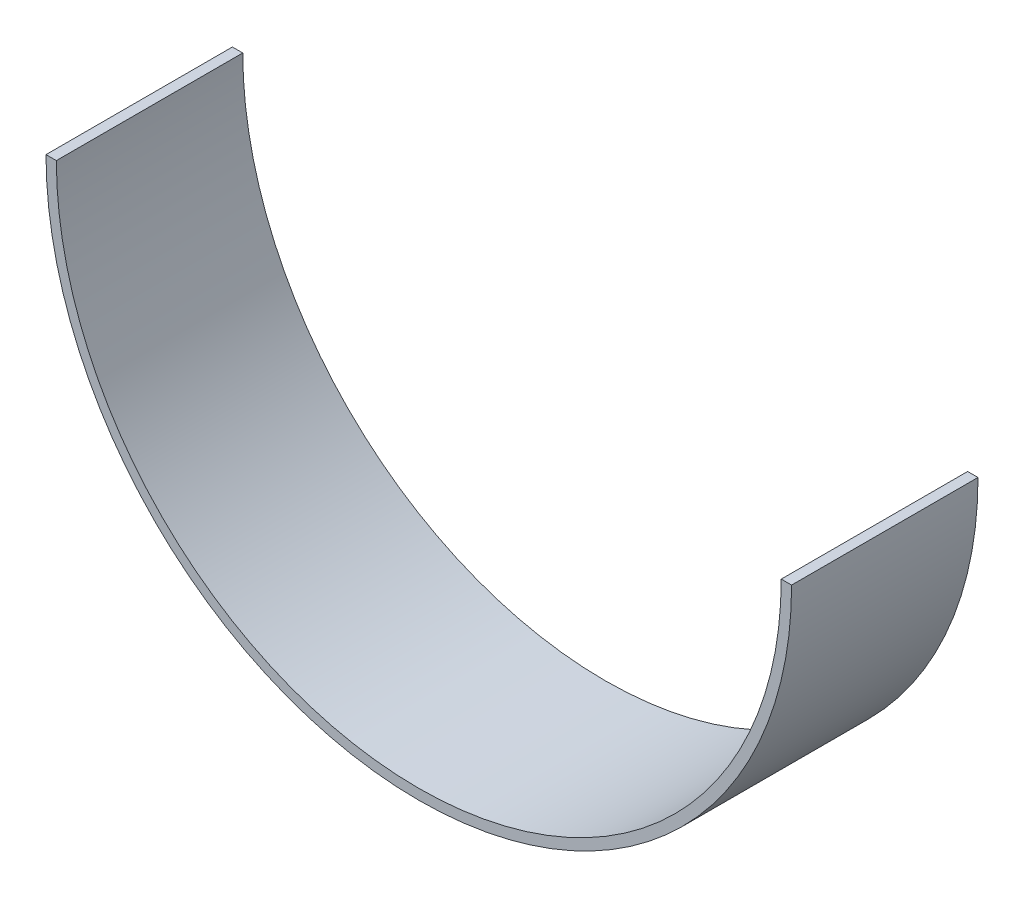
SolidWorks part; units mm, degrees
ref_plane "Front Plane" through (0, 0, 0) normal (0, 0, 1) x (1, 0, 0)
ref_plane "Top Plane" through (0, 0, 0) normal (0, 1, 0) x (1, 0, 0)
ref_plane "Right Plane" through (0, 0, 0) normal (1, 0, 0) x (0, 0, -1)
sketch "Sketch1" plane through (0, 0, 0) normal (0, 0, 1) x (1, 0, 0)
  line L0 (0, 0) -> (3.175, 0)
  line L1 (228.6, 0) -> (225.425, 0)
  arc A0 (0, 0) -> (228.6, 0) centre (114.3, 0) ccw
  arc A1 (3.175, 0) -> (225.425, 0) centre (114.3, 0) ccw
extrude "Extrude1" add sketch "Sketch1" along normal blind 57.15
